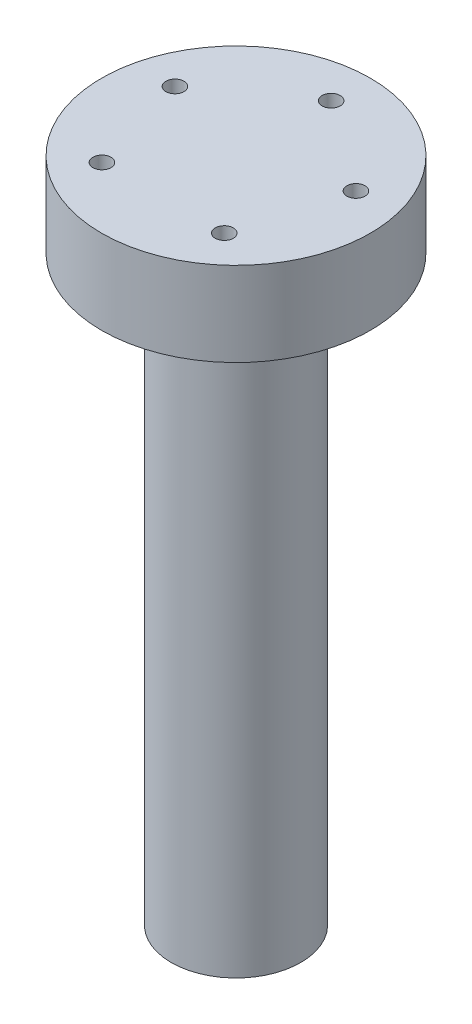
SolidWorks part; units mm, degrees
ref_plane "Front Plane" through (0, 0, 0) normal (0, 0, 1) x (1, 0, 0)
ref_plane "Top Plane" through (0, 0, 0) normal (0, 1, 0) x (1, 0, 0)
ref_plane "Right Plane" through (0, 0, 0) normal (1, 0, 0) x (0, 0, -1)
sketch "Sketch1" plane through (0, 0, 0) normal (0, 1, 0) x (1, 0, 0)
  line L0 (0, 0) -> (0, 45.1443) construction
  circle A0 centre (0, 0) radius 38.1
  circle A1 centre (0, 0) radius 26.9875 construction
  dimension "D1" = 53.975
  dimension "D2" = 76.2
extrude "Body" add sketch "Sketch1" along normal blind 23.876
sketch "Sketch3" plane through (0, 23.876, 0) normal (0, 1, 0) x (1, 0, 0)
  circle A0 centre (0, 26.9875) radius 2.5654
  circle A1 centre (0, 0) radius 26.9875 construction
  circle A2 centre (25.6666, 8.3396) radius 2.5654
  circle A3 centre (17.3472, -20.6736) radius 2.5654
  circle A4 centre (-17.3472, -20.6736) radius 2.5654
  circle A5 centre (-25.6666, 8.3396) radius 2.5654
  dimension "D1" = 5.1308
  dimension "D2" = 72
  dimension "D3" = 68
  dimension "D4" = 80
  dimension "D5" = 68
extrude "Mount Holes" cut sketch "Sketch3" against normal through all both and the other way through all
sketch "Sketch2" plane through (0, 0, 0) normal (0, 1, 0) x (1, 0, 0)
  circle A0 centre (0, 0) radius 18.3705
  dimension "D1" = 36.7411
extrude "Tube" add sketch "Sketch2" against normal blind 165.1
